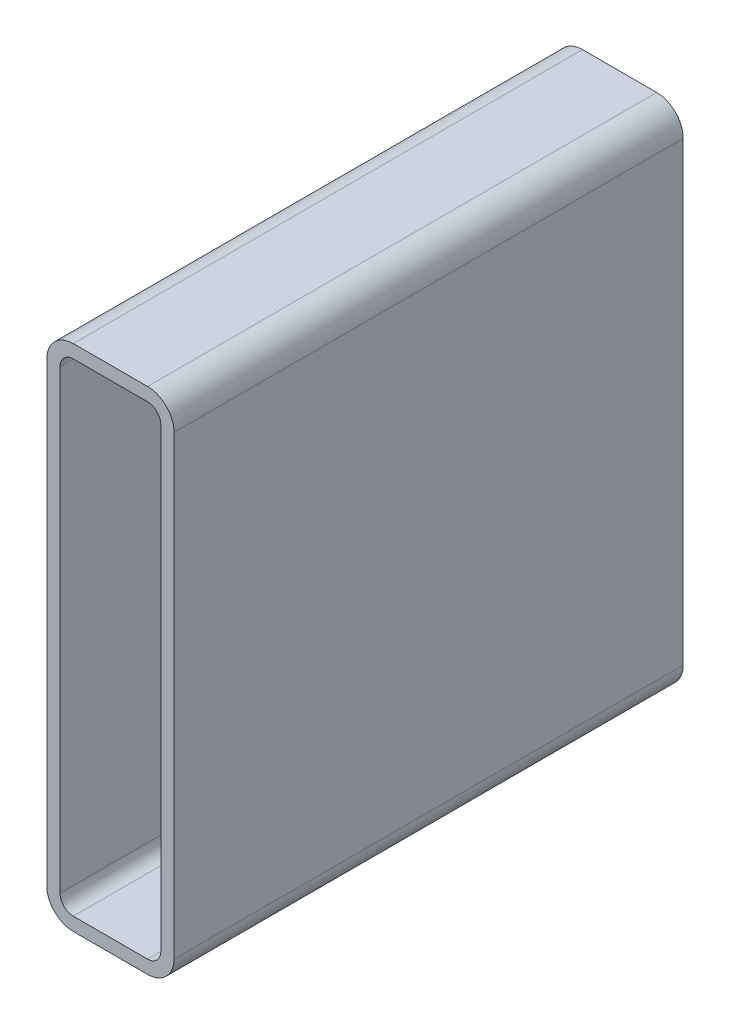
SolidWorks part; units mm, degrees
ref_plane "Front Plane" through (0, 0, 0) normal (0, 0, 1) x (1, 0, 0)
ref_plane "Top Plane" through (0, 0, 0) normal (0, 1, 0) x (1, 0, 0)
ref_plane "Right Plane" through (0, 0, 0) normal (1, 0, 0) x (0, 0, -1)
sketch "Sketch1" plane through (0, 0, 0) normal (0, 0, 1) x (1, 0, 0)
sketch_block_instance "HSS12x3x0.3125-1"
sketch_block "HSS12x3x0.3125"
extrude "Boss-Extrude1" add sketch "Sketch1" along normal blind 304.8
